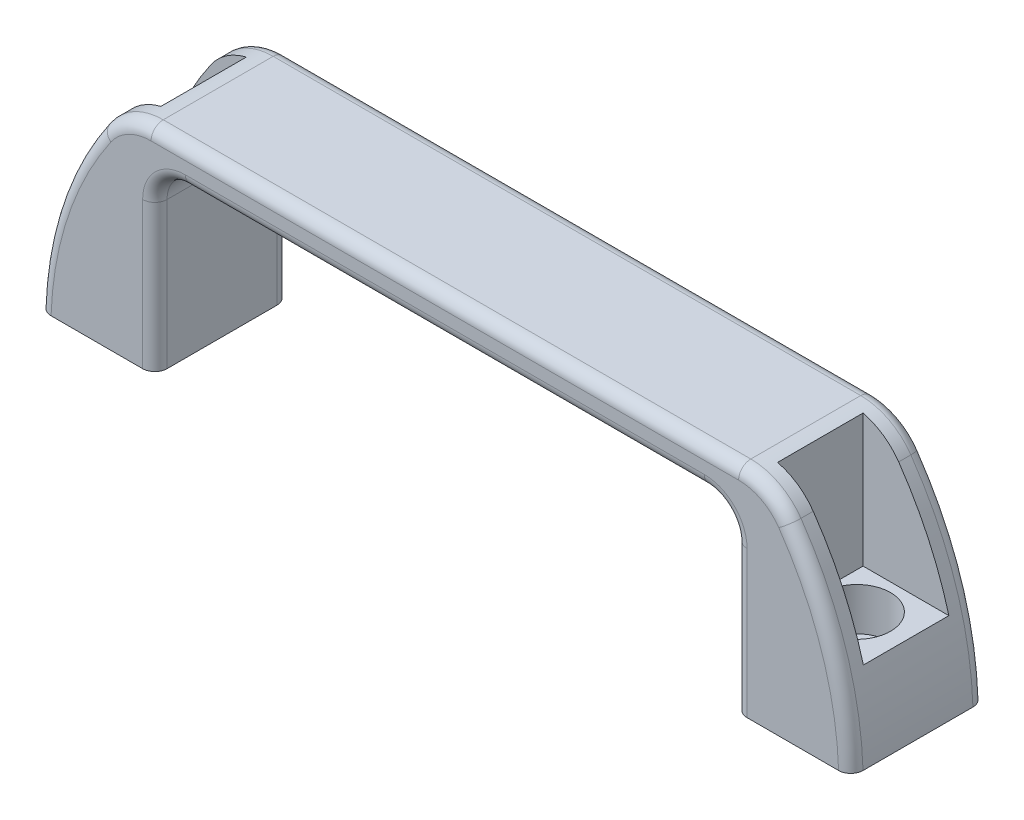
SolidWorks part; units mm, degrees
ref_plane "正面" through (0, 0, 0) normal (0, 0, 1) x (1, 0, 0)
ref_plane "平面" through (0, 0, 0) normal (0, 1, 0) x (1, 0, 0)
ref_plane "右側面" through (0, 0, 0) normal (1, 0, 0) x (0, 0, -1)
sketch "ｽｹｯﾁ1" plane through (0, 0, 0) normal (0, 0, 1) x (1, 0, 0)
  line L0 (408.1722, 64.7928) -> (427.1722, 64.7928)
  line L1 (432.1722, 93.7928) -> (517.1722, 93.7928)
  line L2 (426.5528, 99.7928) -> (522.7916, 99.7928)
  line L3 (427.1722, 88.7928) -> (427.1722, 64.7928)
  line L4 (522.1722, 88.7928) -> (522.1722, 64.7928)
  line L5 (522.1722, 64.7928) -> (541.1722, 64.7928)
  arc A0 (426.5528, 99.7928) -> (418.3347, 95.4904) centre (426.5528, 89.7928) ccw
  arc A1 (418.3347, 95.4904) -> (408.1722, 64.7928) centre (465.3491, 62.8952) ccw
  arc A2 (432.1722, 93.7928) -> (427.1722, 88.7928) centre (432.1722, 88.7928) ccw
  arc A3 (541.1722, 64.7928) -> (531.0097, 95.4904) centre (483.9953, 62.8952) ccw
  arc A4 (522.1722, 88.7928) -> (517.1722, 93.7928) centre (517.1722, 88.7928) ccw
  arc A5 (531.0097, 95.4904) -> (522.7916, 99.7928) centre (522.7916, 89.7928) ccw
extrude "押し出し1" add sketch "ｽｹｯﾁ1" along normal mid plane 22
sketch "ｽｹｯﾁ2" plane through (0, 0, 0) normal (0, 0, 1) x (1, 0, 0)
  line L0 (522.1722, 64.7928) -> (541.1722, 64.7928) construction
  line L1 (525.1722, 77.7928) -> (541.2535, 77.7928)
  line L2 (525.1722, 77.7928) -> (525.1722, 101.5587)
  line L3 (525.1722, 101.5587) -> (541.2535, 101.5587)
  line L4 (541.2535, 77.7928) -> (541.2535, 101.5587)
  line L5 (408.1722, 64.7928) -> (427.1722, 64.7928) construction
  line L6 (427.1722, 64.7928) -> (427.1722, 88.7928) construction
  line L9 (522.1722, 88.7928) -> (522.1722, 64.7928) construction
  line L10 (406.7368, 77.7928) -> (424.1722, 77.7928)
  line L11 (406.7368, 77.7928) -> (406.7368, 101.5587)
  line L12 (406.7368, 101.5587) -> (424.1722, 101.5587)
  line L13 (424.1722, 77.7928) -> (424.1722, 101.5587)
  point P4 (417.6722, 64.7928)
  dimension "D1" = 13
  dimension "D2" = 3
  dimension "D3" = 13
  dimension "D4" = 3
extrude "押し出し2" cut sketch "ｽｹｯﾁ2" against normal mid plane 14
hole_wizard "穴1" positions "3Dｽｹｯﾁ1" profile "ｽｹｯﾁ4" legacy
sketch3d "3Dｽｹｯﾁ1"
  point P0 (531.1722, 77.7928, 0)
  point P2 (418.1722, 77.7928, 0)
  dimension "D1" = 7
  dimension "D2" = 6
  dimension "D3" = 6
sketch "ｽｹｯﾁ4" plane through (531.1722, 77.7928, 0) normal (1, 0, 0) x (0, 0, 1)
  line L0 (0, 0) -> (0, 13)
  line L1 (0, 13) -> (3.3, 13)
  line L3 (3.3, 13) -> (3.3, 7)
  line L4 (3.3, 7) -> (5.5, 7)
  line L5 (5.5, 7) -> (5.5, 0)
  line L7 (5.5, 0) -> (0, 0)
  line L11 (0, -6.35) -> (0, 107.95) construction
  dimension "通し穴の直径" = 6.6
  dimension "通し穴の深さ" = 13
  dimension "座ぐり穴の直径" = 11
  dimension "座ぐり穴の深さ" = 7
fillet "ﾌｨﾚｯﾄ1" radius 2 20 edges at (427.1722, 76.7928, 11) (428.6367, 92.3283, 11) (522.1722, 76.7928, 11) (520.7077, 92.3283, 11) (427.1722, 76.7928, -11) (428.6367, 92.3283, -11) (522.1722, 76.7928, -11) (520.7077, 92.3283, -11) (538.305, 80.8745, -11) (527.4297, 98.6521, -11) (411.0394, 80.8745, -11) (421.9147, 98.6521, -11) (538.305, 80.8745, 11) (527.4297, 98.6521, 11) (474.6722, 99.7928, 11) (421.9147, 98.6521, 11) (474.6722, 93.7928, 11) (474.6722, 93.7928, -11) (474.6722, 99.7928, -11) (411.0394, 80.8745, 11)
